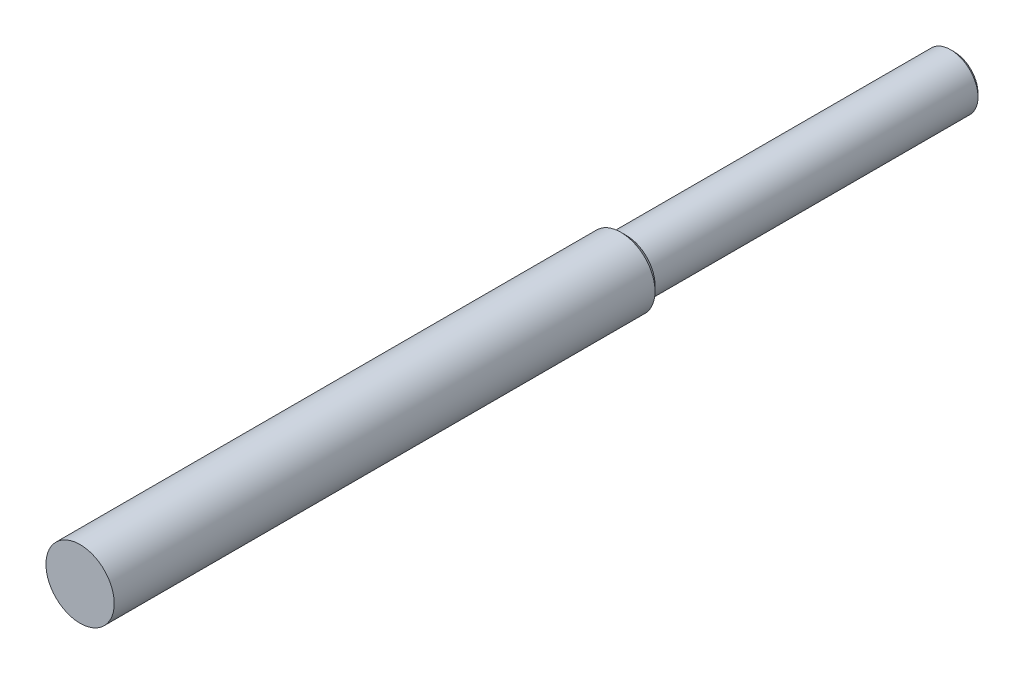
SolidWorks part; units mm, degrees
ref_plane "Face" through (0, 0, 0) normal (0, 0, 1) x (1, 0, 0)
ref_plane "Dessus" through (0, 0, 0) normal (0, 1, 0) x (1, 0, 0)
ref_plane "Droite" through (0, 0, 0) normal (1, 0, 0) x (0, 0, -1)
sketch "Esquisse1" plane through (0, 0, 0) normal (0, 0, 1) x (1, 0, 0)
  circle A0 centre (0, 0) radius 12.5
  dimension "D1" = 25
extrude "Extrusion1" add sketch "Esquisse1" along normal blind 200
sketch "Esquisse2" plane through (0, 0, 0) normal (0, 0, -1) x (-1, 0, 0)
  circle A0 centre (0, 0) radius 10
  dimension "D1" = 20
extrude "Extrusion2" add sketch "Esquisse2" along normal blind 120
chamfer "Chanfrein1" distance 1.25 angle 45 1 edges at (-10, 0, -120)
chamfer "Chanfrein2" distance 2 angle 45 1 edges at (12.5, 0, 0)
